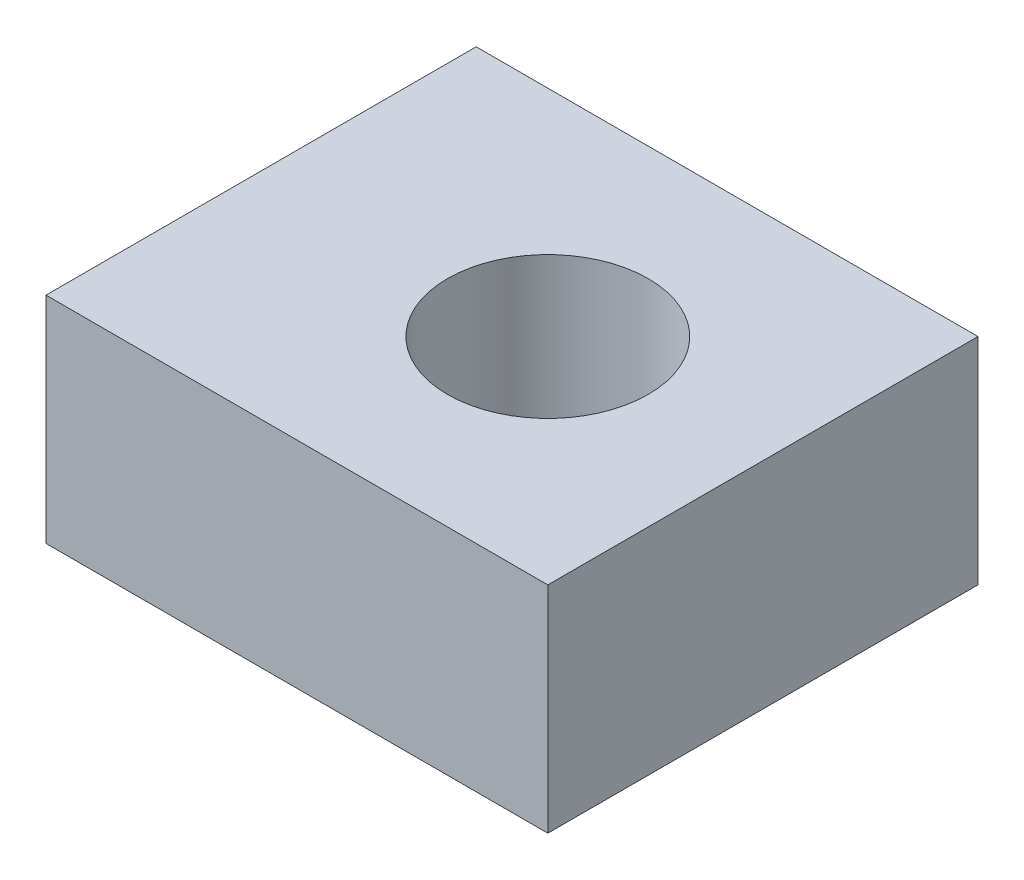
SolidWorks part; units mm, degrees
ref_plane "Plan de face" through (0, 0, 0) normal (0, 0, 1) x (1, 0, 0)
ref_plane "Plan de dessus" through (0, 0, 0) normal (0, 1, 0) x (1, 0, 0)
ref_plane "Plan de droite" through (0, 0, 0) normal (1, 0, 0) x (0, 0, -1)
sketch "Esquisse1" plane through (0, 0, 0) normal (0, 0, 1) x (1, 0, 0)
  line L1 (0, 0) -> (35, 0)
  line L2 (0, 0) -> (0, 15)
  line L3 (0, 15) -> (35, 15)
  line L4 (35, 0) -> (35, 15)
  dimension "D1" = 35
  dimension "D2" = 15
extrude "Extrusion1" add sketch "Esquisse1" along normal blind 30
hole_wizard "Trou taraudé M16x2.01" positions "Esquisse3" profile "Esquisse2" tap size "M16x2.0" standard "ISO"
sketch "Esquisse3" plane through (0, 15, 0) normal (0, 1, 0) x (-1, 0, 0)
  line L0 (-35, 30) -> (-35, 0) construction
  line L1 (-35, 0) -> (0, 0) construction
  point P0 (-20, 15)
  dimension "D1" = 15
  dimension "D2" = 15
sketch "Esquisse2" plane through (20, 15, 15) normal (1, 0, 0) x (0, 0, 1)
  line L0 (0, 0) -> (0, 42.206)
  line L1 (0, 42.206) -> (7, 38)
  line L2 (7, 38) -> (7, 0)
  line L5 (7, 0) -> (0, 0)
  line L10 (0, 42.206) -> (-7, 38) construction
  line L11 (0, -6.35) -> (0, 107.95) construction
  dimension "Diamètre du trou pour taraudage" = 14
  dimension "Profondeur du trou pour taraudage" = 38
  dimension "Angle de pointe" = 118
